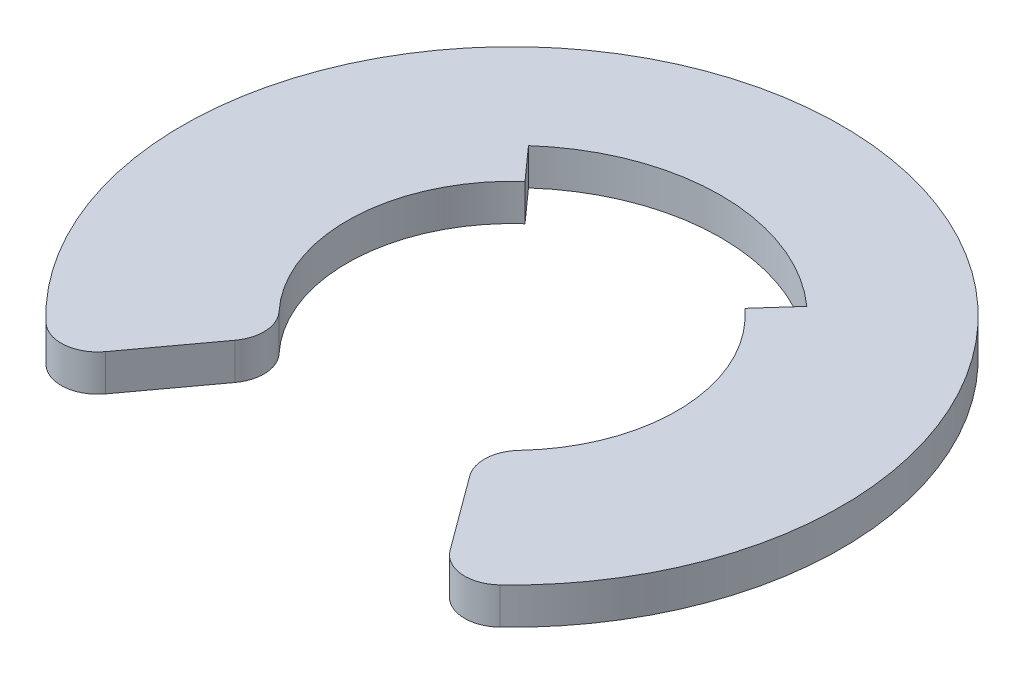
SolidWorks part; units mm, degrees
ref_plane "Front" through (0, 0, 0) normal (0, 0, 1) x (1, 0, 0)
ref_plane "Top" through (0, 0, 0) normal (0, 1, 0) x (1, 0, 0)
ref_plane "Right" through (0, 0, 0) normal (1, 0, 0) x (0, 0, -1)
sketch "Sketch1" plane through (0, 0, 0) normal (0, 1, 0) x (1, 0, 0)
  circle A0 centre (0, 0) radius 4.5
  dimension "D1" = 9
extrude "Base-Extrude" add sketch "Sketch1" along normal blind 0.5
sketch "Sketch2" plane through (0, 0.5, 0) normal (0, 1, 0) x (-1, 0, 0)
  circle A0 centre (0, 0) radius 2.25
  circle A1 centre (0, 0) radius 4.5 construction
  dimension "D1" = 4.5
extrude "Cut-Extrude1" cut sketch "Sketch2" against normal through all
sketch "草图1" plane through (0, 0.5, 0) normal (0, 1, 0) x (1, 0, 0)
  line L0 (0, 0) -> (0, -5.3524) construction
  line L1 (0, 0) -> (-3.1771, -4.3204)
  line L2 (0, 0) -> (3.1771, -4.3204)
extrude "切除-拉伸1" cut sketch "草图1" against normal through all and the other way through all
fillet "圆角1" radius 0.5 4 edges at (-1.333, 0.25, 1.8127) (-2.6659, 0.25, 3.6253) (2.6659, 0.25, 3.6253) (1.333, 0.25, 1.8127)
sketch "草图2" plane through (0, 0.5, 0) normal (0, 1, 0) x (1, 0, 0)
  line L0 (0, 0) -> (0, 3.6066) construction
  arc A0 (1.6403, -1.5401) -> (-1.6403, -1.5401) centre (0, 0) ccw construction
  arc A1 (1.5, 1.6771) -> (-1.5, 1.6771) centre (0, 0) ccw
  dimension "D1" = 3
extrude "切除-拉伸-薄壁1" cut sketch "草图2" against normal through all thin
